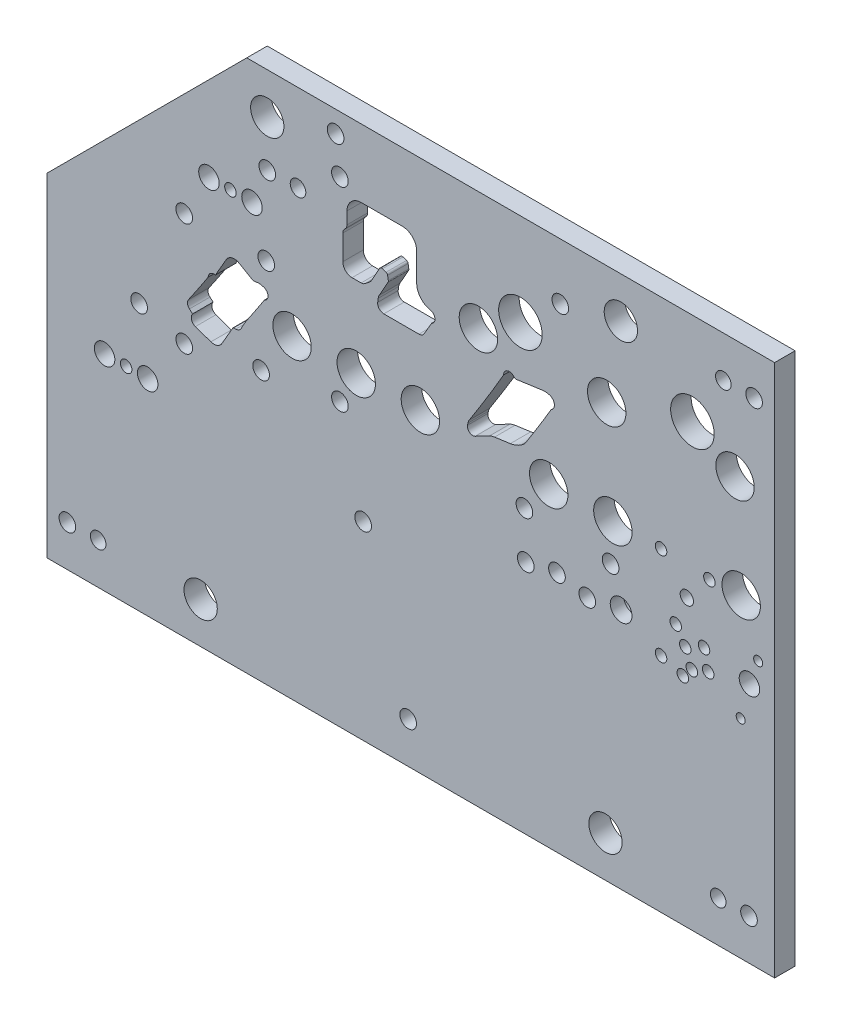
SolidWorks part; units mm, degrees
ref_plane "Front" through (0, 0, 0) normal (0, 0, 1) x (1, 0, 0)
ref_plane "Top" through (0, 0, 0) normal (0, 1, 0) x (1, 0, 0)
ref_plane "Right" through (0, 0, 0) normal (1, 0, 0) x (0, 0, -1)
sketch "Sketch1" plane through (0, 0, 0) normal (0, 0, 1) x (1, 0, 0)
  line L4 (-1196.34, -180.975) -> (-745.49, -180.975)
  line L5 (-1196.34, 25.4) -> (-1196.34, -180.975)
  line L6 (-745.49, 149.225) -> (-1072.515, 149.225)
  line L7 (-745.49, -180.975) -> (-745.49, 149.225)
  line L8 (-1196.34, -180.975) -> (-745.49, -180.975)
  line L9 (-1196.34, 25.4) -> (-1196.34, -180.975)
  line L10 (-745.49, 149.225) -> (-1072.515, 149.225)
  line L11 (-745.49, -180.975) -> (-745.49, 149.225)
  line L26 (-1072.515, 149.225) -> (-1196.34, 25.4)
  line L27 (-1072.515, 149.225) -> (-1196.34, 25.4)
  dimension "D1" = 0
extrude "Boss-Extrude1" add sketch "Sketch1" along normal blind 12.7 separate body
hole_wizard "Hole1" positions "Point_Sketch" profile "Profil_Sketch" hole size "Ø0.15" standard "ISO"
sketch "Point_Sketch" plane through (-798.7005, -36.6401, 0) normal (0, 0, 1) x (-1, 0, 0)
  point P0 (3.6543, 10.6011)
  point P2 (-1.9225, 4.5369)
sketch "Profil_Sketch" plane through (-802.3548, -47.2413, 0) normal (1, 0, 0) x (0, 1, 0)
  line L0 (0, 0) -> (0, 12.7)
  line L1 (0, 12.7) -> (3.5719, 12.7)
  line L2 (3.5719, 12.7) -> (3.5719, 0)
  line L5 (3.5719, 0) -> (0, 0)
  line L11 (0, -6.35) -> (0, 107.95) construction
  dimension "Diameter" = 7.1437
  dimension "Thru Hole Depth" = 12.7
other "usin_DL090<1>"
hole_wizard "Hole11" positions "Point_Sketch1" profile "Profil_Sketch1" hole size "Ø0.15" standard "ISO"
sketch "Point_Sketch1" plane through (-785.5665, -14.9521, 0) normal (0, 0, 1) x (-1, 0, 0)
  point P0 (3.6543, 10.6011)
sketch "Profil_Sketch1" plane through (-789.2208, -25.5532, 0) normal (1, 0, 0) x (0, 1, 0)
  line L0 (0, 0) -> (0, 12.7)
  line L1 (0, 12.7) -> (3.5719, 12.7)
  line L2 (3.5719, 12.7) -> (3.5719, 0)
  line L5 (3.5719, 0) -> (0, 0)
  line L11 (0, -6.35) -> (0, 107.95) construction
  dimension "Diameter" = 7.1437
  dimension "Thru Hole Depth" = 12.7
other "usin_DL090<2>"
hole_wizard "Hole12" positions "Point_Sketch2" profile "Profil_Sketch2" hole size "Ø0.15" standard "ISO"
sketch "Point_Sketch2" plane through (-803.1061, -11.0849, 0) normal (0, 0, 1) x (-1, 0, 0)
  point P0 (3.6543, 10.6011)
sketch "Profil_Sketch2" plane through (-806.7604, -21.6861, 0) normal (1, 0, 0) x (0, 1, 0)
  line L0 (0, 0) -> (0, 12.7)
  line L1 (0, 12.7) -> (3.5719, 12.7)
  line L2 (3.5719, 12.7) -> (3.5719, 0)
  line L5 (3.5719, 0) -> (0, 0)
  line L11 (0, -6.35) -> (0, 107.95) construction
  dimension "Diameter" = 7.1437
  dimension "Thru Hole Depth" = 12.7
other "usin_DL090<3>"
hole_wizard "Hole13" positions "Point_Sketch3" profile "Profil_Sketch3" hole size "Ø0.15" standard "ISO"
sketch "Point_Sketch3" plane through (-803.5274, 6.4914, 12.7) normal (0, 0, -1) x (1, 0, 0)
  point P0 (3.6543, 10.6011)
sketch "Profil_Sketch3" plane through (-799.8731, -4.1097, 12.7) normal (1, 0, 0) x (0, -1, 0)
  line L0 (0, 0) -> (0, 12.7)
  line L1 (0, 12.7) -> (4.1338, 12.7)
  line L2 (4.1338, 12.7) -> (4.1338, 0)
  line L5 (4.1338, 0) -> (0, 0)
  line L11 (0, -6.35) -> (0, 107.95) construction
  dimension "Diameter" = 8.2677
  dimension "Thru Hole Depth" = 12.7
other "usin_DL090_DAYTON VERSATILE INCH VPO-50-2130-P0.1999-W0.1310 X2-0<4>"
hole_wizard "Hole14" positions "Point_Sketch4" profile "Profil_Sketch4" hole size "Ø0.15" standard "ISO"
sketch "Point_Sketch4" plane through (-804.4841, -20.3493, 12.7) normal (0, 0, -1) x (1, 0, 0)
  point P0 (3.6543, 10.6011)
sketch "Profil_Sketch4" plane through (-800.8298, -30.9504, 12.7) normal (1, 0, 0) x (0, -1, 0)
  line L0 (0, 0) -> (0, 12.7)
  line L1 (0, 12.7) -> (3.5719, 12.7)
  line L2 (3.5719, 12.7) -> (3.5719, 0)
  line L5 (3.5719, 0) -> (0, 0)
  line L11 (0, -6.35) -> (0, 107.95) construction
  dimension "Diameter" = 7.1437
  dimension "Thru Hole Depth" = 12.7
other "usin_DL090<5>"
hole_wizard "Hole15" positions "Point_Sketch5" profile "Profil_Sketch5" hole size "Ø0.15" standard "ISO"
sketch "Point_Sketch5" plane through (-876.6775, -20.3493, 0) normal (0, 0, 1) x (-1, 0, 0)
  point P0 (3.6543, 10.6011)
sketch "Profil_Sketch5" plane through (-880.3318, -30.9504, 0) normal (1, 0, 0) x (0, 1, 0)
  line L0 (0, 0) -> (0, 12.7)
  line L1 (0, 12.7) -> (5.1594, 12.7)
  line L2 (5.1594, 12.7) -> (5.1594, 0)
  line L5 (5.1594, 0) -> (0, 0)
  line L11 (0, -6.35) -> (0, 107.95) construction
  dimension "Diameter" = 10.3187
  dimension "Thru Hole Depth" = 12.7
other "usin_DL090<6>"
hole_wizard "Hole17" positions "Point_Sketch7" profile "Profil_Sketch7" legacy
sketch "Point_Sketch7" plane through (-836.9265, -20.3493, 0) normal (0, 0, 1) x (-1, 0, 0)
  point P0 (3.6543, 10.6011)
sketch "Profil_Sketch7" plane through (-840.5808, -30.9504, 0) normal (1, 0, 0) x (0, 1, 0)
  line L0 (0, 0) -> (0, 12.7) construction
  line L1 (0, 12.7) -> (6.7469, 12.7)
  line L2 (6.7469, 12.7) -> (6.7469, 4.445)
  line L3 (6.7469, 4.445) -> (10.3187, 4.445)
  line L4 (10.3188, 0) -> (0, 0) construction
  line L5 (0, 12.7) -> (0, -1)
  line L6 (-6.7469, 4.445) -> (-10.3187, 4.445) construction
  line L7 (0, -4.2442) -> (0, 117.3081) construction
  line L8 (0, -1) -> (10.3188, -1)
  line L9 (10.3188, -1) -> (10.3187, 4.445)
  dimension "Diameter" = 13.4937
  dimension "Depth" = 12.7
  dimension "L1" = 4.445
  dimension "A1" = 180
  dimension "FixDim" = 1
other "usin_DS100<1>"
ref_plane "Plane1 QU250515L_Punch1[Mounted in the strip]-2"
sketch "Sketch1 QU250515L_Punch1[Mounted in the strip]-2" plane through (0, 0, 12.7) normal (0, 0, 1) x (1, 0, 0)
  line L7 (-935.5189, 21.735) -> (-935.7511, 20.4767)
  line L8 (-906.2222, 60.3125) -> (-907.5906, 61.4478)
  line L9 (-888.7721, 62.5554) -> (-905.7284, 60.1723)
  line L10 (-885.2997, 62.2271) -> (-886.9844, 62.5242)
  line L11 (-902.6471, 26.4559) -> (-901.3964, 27.3267)
  line L12 (-918.988, 22.5002) -> (-909.2346, 23.8709)
  line L13 (-930.9882, 16.9438) -> (-922.2381, 21.4652)
  line L14 (-935.5189, 21.735) -> (-935.7511, 20.4767)
  line L15 (-906.2222, 60.3125) -> (-907.5906, 61.4478)
  line L16 (-888.7721, 62.5554) -> (-905.7284, 60.1723)
  line L17 (-885.2997, 62.2271) -> (-886.9844, 62.5242)
  line L18 (-902.6471, 26.4559) -> (-901.3964, 27.3267)
  line L19 (-918.988, 22.5002) -> (-909.2346, 23.8709)
  line L20 (-930.9882, 16.9438) -> (-922.2381, 21.4652)
  arc A13 (-934.7197, 23.7493) -> (-935.5189, 21.735) centre (-930.0237, 20.7206) ccw
  arc A14 (-934.7197, 23.7493) -> (-913.3896, 58.6232) centre (-1653.9165, 487.596) ccw
  arc A15 (-907.5906, 61.4478) -> (-913.3896, 58.6232) centre (-909.851, 58.7234) ccw
  arc A16 (-906.2222, 60.3125) -> (-905.7284, 60.1723) centre (-905.8168, 60.8012) ccw
  arc A17 (-886.9844, 62.5242) -> (-888.7721, 62.5554) centre (-887.9768, 56.896) ccw
  arc A18 (-883.9457, 54.7215) -> (-885.2997, 62.2271) centre (-886.0054, 58.2249) ccw
  arc A19 (-899.8876, 28.893) -> (-883.9457, 54.7215) centre (-1614.1655, 487.596) ccw
  arc A20 (-901.3964, 27.3267) -> (-899.8876, 28.893) centre (-904.5895, 31.9125) ccw
  arc A21 (-909.2346, 23.8709) -> (-902.6471, 26.4559) centre (-911.3556, 38.9626) ccw
  arc A22 (-918.988, 22.5002) -> (-922.2381, 21.4652) centre (-917.574, 12.4391) ccw
  arc A23 (-935.7511, 20.4767) -> (-930.9882, 16.9438) centre (-932.504, 19.8773) ccw
  arc A24 (-934.7197, 23.7493) -> (-935.5189, 21.735) centre (-930.0237, 20.7206) ccw
  arc A25 (-934.7197, 23.7493) -> (-913.3896, 58.6232) centre (-1653.9165, 487.596) ccw
  arc A26 (-907.5906, 61.4478) -> (-913.3896, 58.6232) centre (-909.851, 58.7234) ccw
  arc A27 (-906.2222, 60.3125) -> (-905.7284, 60.1723) centre (-905.8168, 60.8012) ccw
  arc A28 (-886.9844, 62.5242) -> (-888.7721, 62.5554) centre (-887.9768, 56.896) ccw
  arc A29 (-883.9457, 54.7215) -> (-885.2997, 62.2271) centre (-886.0054, 58.2249) ccw
  arc A30 (-899.8876, 28.893) -> (-883.9457, 54.7215) centre (-1614.1655, 487.596) ccw
  arc A31 (-901.3964, 27.3267) -> (-899.8876, 28.893) centre (-904.5895, 31.9125) ccw
  arc A32 (-909.2346, 23.8709) -> (-902.6471, 26.4559) centre (-911.3556, 38.9626) ccw
  arc A33 (-918.988, 22.5002) -> (-922.2381, 21.4652) centre (-917.574, 12.4391) ccw
  arc A34 (-935.7511, 20.4767) -> (-930.9882, 16.9438) centre (-932.504, 19.8773) ccw
ref_plane "Plane1 QU250515L_Punch4[Mounted in the strip]-1"
sketch "Sketch1 QU250515L_Punch4[Mounted in the strip]-1" plane through (0, 0, 12.7) normal (0, 0, 1) x (1, 0, 0)
  line L10 (-987.6114, 54.3135) -> (-965.8621, 54.3135)
  line L11 (-991.0943, 60.8918) -> (-991.3898, 58.6134)
  line L12 (-985.2465, 76.1838) -> (-984.8109, 73.5354)
  line L13 (-988.4834, 78.0815) -> (-986.2272, 77.3325)
  line L14 (-999.3188, 64.6872) -> (-996.6929, 66.7362)
  line L15 (-1004.697, 63.881) -> (-1001.6626, 63.881)
  line L16 (-1010.412, 98.171) -> (-1010.412, 69.596)
  line L17 (-976.122, 107.061) -> (-1001.522, 107.061)
  line L18 (-967.232, 80.8774) -> (-967.232, 98.171)
  line L19 (-958.4084, 70.6586) -> (-960.0594, 71.1665)
  line L20 (-987.6114, 54.3135) -> (-965.8621, 54.3135)
  line L21 (-991.0943, 60.8918) -> (-991.3898, 58.6134)
  line L22 (-985.2465, 76.1838) -> (-984.8109, 73.5354)
  line L23 (-988.4834, 78.0815) -> (-986.2272, 77.3325)
  line L24 (-999.3188, 64.6872) -> (-996.6929, 66.7362)
  line L25 (-1004.697, 63.881) -> (-1001.6626, 63.881)
  line L26 (-1010.412, 98.171) -> (-1010.412, 69.596)
  line L27 (-976.122, 107.061) -> (-1001.522, 107.061)
  line L28 (-967.232, 80.8774) -> (-967.232, 98.171)
  line L29 (-958.4084, 70.6586) -> (-960.0594, 71.1665)
  arc A17 (-991.3898, 58.6134) -> (-987.6114, 54.3135) centre (-987.6114, 58.1235) ccw
  arc A18 (-990.4043, 62.946) -> (-991.0943, 60.8918) centre (-985.5527, 60.1732) ccw
  arc A19 (-990.4043, 62.946) -> (-984.9747, 72.5904) centre (-1733.4185, 487.596) ccw
  arc A20 (-984.9747, 72.5904) -> (-984.8109, 73.5354) centre (-986.2515, 73.2984) ccw
  arc A21 (-985.2465, 76.1838) -> (-986.2272, 77.3325) centre (-986.6871, 75.9469) ccw
  arc A22 (-988.4834, 78.0815) -> (-990.2216, 77.4013) centre (-988.9433, 76.6958) ccw
  arc A23 (-995.2714, 68.3821) -> (-990.2216, 77.4013) centre (-1733.4185, 487.596) ccw
  arc A24 (-996.6929, 66.7362) -> (-995.2714, 68.3821) centre (-1000.1305, 71.1417) ccw
  arc A25 (-1001.6626, 63.881) -> (-999.3188, 64.6872) centre (-1001.6626, 67.691) ccw
  arc A26 (-1010.412, 69.596) -> (-1004.697, 63.881) centre (-1004.697, 69.596) ccw
  arc A27 (-1001.522, 107.061) -> (-1010.412, 98.171) centre (-1001.522, 98.171) ccw
  arc A28 (-967.232, 98.171) -> (-976.122, 107.061) centre (-976.122, 98.171) ccw
  arc A29 (-967.232, 80.8774) -> (-960.0594, 71.1665) centre (-957.072, 80.8774) ccw
  arc A30 (-958.0004, 64.0452) -> (-958.4084, 70.6586) centre (-959.4493, 67.2751) ccw
  arc A31 (-962.5808, 56.1872) -> (-958.0004, 64.0452) centre (-1693.6675, 487.596) ccw
  arc A32 (-965.8621, 54.3135) -> (-962.5808, 56.1872) centre (-965.8621, 58.1235) ccw
  arc A33 (-991.3898, 58.6134) -> (-987.6114, 54.3135) centre (-987.6114, 58.1235) ccw
  arc A34 (-990.4043, 62.946) -> (-991.0943, 60.8918) centre (-985.5527, 60.1732) ccw
  arc A35 (-990.4043, 62.946) -> (-984.9747, 72.5904) centre (-1733.4185, 487.596) ccw
  arc A36 (-984.9747, 72.5904) -> (-984.8109, 73.5354) centre (-986.2515, 73.2984) ccw
  arc A37 (-985.2465, 76.1838) -> (-986.2272, 77.3325) centre (-986.6871, 75.9469) ccw
  arc A38 (-988.4834, 78.0815) -> (-990.2216, 77.4013) centre (-988.9433, 76.6958) ccw
  arc A39 (-995.2714, 68.3821) -> (-990.2216, 77.4013) centre (-1733.4185, 487.596) ccw
  arc A40 (-996.6929, 66.7362) -> (-995.2714, 68.3821) centre (-1000.1305, 71.1417) ccw
  arc A41 (-1001.6626, 63.881) -> (-999.3188, 64.6872) centre (-1001.6626, 67.691) ccw
  arc A42 (-1010.412, 69.596) -> (-1004.697, 63.881) centre (-1004.697, 69.596) ccw
  arc A43 (-1001.522, 107.061) -> (-1010.412, 98.171) centre (-1001.522, 98.171) ccw
  arc A44 (-967.232, 98.171) -> (-976.122, 107.061) centre (-976.122, 98.171) ccw
  arc A45 (-967.232, 80.8774) -> (-960.0594, 71.1665) centre (-957.072, 80.8774) ccw
  arc A46 (-958.0004, 64.0452) -> (-958.4084, 70.6586) centre (-959.4493, 67.2751) ccw
  arc A47 (-962.5808, 56.1872) -> (-958.0004, 64.0452) centre (-1693.6675, 487.596) ccw
  arc A48 (-965.8621, 54.3135) -> (-962.5808, 56.1872) centre (-965.8621, 58.1235) ccw
ref_plane "Plane1 QU250515L_Punch5[Mounted in the strip]-2"
sketch "Sketch1 QU250515L_Punch5[Mounted in the strip]-2" plane through (0, 0, 12.7) normal (0, 0, 1) x (1, 0, 0)
  line L9 (-1080.5961, 0.2711) -> (-1079.3261, 0.2711)
  line L10 (-1061.6993, 31.325) -> (-1062.1784, 31.4939)
  line L11 (-1069.5951, 32.2499) -> (-1077.3993, 36.7556)
  line L12 (-1085.2061, 34.6638) -> (-1091.9762, 22.9377)
  line L14 (-1108.0194, -3.2428) -> (-1106.0659, -4.9392)
  line L15 (-1104.3303, -10.8785) -> (-1094.7387, -14.2592)
  line L16 (-1087.8896, -11.7267) -> (-1081.146, -0.0464)
  line L17 (-1080.5961, 0.2711) -> (-1079.3261, 0.2711)
  line L18 (-1061.6993, 31.325) -> (-1062.1784, 31.4939)
  line L19 (-1069.5951, 32.2499) -> (-1077.3993, 36.7556)
  line L20 (-1085.2061, 34.6638) -> (-1091.9762, 22.9377)
  line L22 (-1108.0194, -3.2428) -> (-1106.0659, -4.9392)
  line L23 (-1104.3303, -10.8785) -> (-1094.7387, -14.2592)
  line L24 (-1087.8896, -11.7267) -> (-1081.146, -0.0464)
  arc A17 (-1079.3261, 0.2711) -> (-1075.8992, 2.4159) centre (-1079.3261, 4.0811) ccw
  arc A18 (-1072.3486, 8.5851) -> (-1075.8992, 2.4159) centre (-1030.0901, -19.8428) ccw
  arc A19 (-1072.3486, 8.5851) -> (-1061.6159, 24.6782) centre (-1773.1695, 487.596) ccw
  arc A20 (-1061.6159, 24.6782) -> (-1061.6993, 31.325) centre (-1062.876, 27.9863) ccw
  arc A21 (-1062.1784, 31.4939) -> (-1066.9232, 31.8175) centre (-1065.1336, 23.1095) ccw
  arc A22 (-1069.5951, 32.2499) -> (-1066.9232, 31.8175) centre (-1067.6901, 35.5495) ccw
  arc A23 (-1077.3993, 36.7556) -> (-1085.2061, 34.6638) centre (-1080.2568, 31.8063) ccw
  arc A25 (-1091.9762, 22.9377) -> (-1096.4074, 19.6145) centre (-1092.8689, 19.5121) ccw
  arc A26 (-1108.6116, 1.441) -> (-1096.4074, 19.6145) centre (-1812.9205, 487.596) ccw
  arc A27 (-1108.6116, 1.441) -> (-1108.0194, -3.2428) centre (-1105.6982, -0.57) ccw
  arc A28 (-1106.0659, -4.9392) -> (-1104.3303, -10.8785) centre (-1103.0637, -7.2851) ccw
  arc A29 (-1094.7387, -14.2592) -> (-1087.8896, -11.7267) centre (-1092.8389, -8.8692) ccw
  arc A30 (-1080.5961, 0.2711) -> (-1081.146, -0.0464) centre (-1080.5961, -0.3639) ccw
  arc A31 (-1079.3261, 0.2711) -> (-1075.8992, 2.4159) centre (-1079.3261, 4.0811) ccw
  arc A32 (-1072.3486, 8.5851) -> (-1075.8992, 2.4159) centre (-1030.0901, -19.8428) ccw
  arc A33 (-1072.3486, 8.5851) -> (-1061.6159, 24.6782) centre (-1773.1695, 487.596) ccw
  arc A34 (-1061.6159, 24.6782) -> (-1061.6993, 31.325) centre (-1062.876, 27.9863) ccw
  arc A35 (-1062.1784, 31.4939) -> (-1066.9232, 31.8175) centre (-1065.1336, 23.1095) ccw
  arc A36 (-1069.5951, 32.2499) -> (-1066.9232, 31.8175) centre (-1067.6901, 35.5495) ccw
  arc A37 (-1077.3993, 36.7556) -> (-1085.2061, 34.6638) centre (-1080.2568, 31.8063) ccw
  arc A39 (-1091.9762, 22.9377) -> (-1096.4074, 19.6145) centre (-1092.8689, 19.5121) ccw
  arc A40 (-1108.6116, 1.441) -> (-1096.4074, 19.6145) centre (-1812.9205, 487.596) ccw
  arc A41 (-1108.6116, 1.441) -> (-1108.0194, -3.2428) centre (-1105.6982, -0.57) ccw
  arc A42 (-1106.0659, -4.9392) -> (-1104.3303, -10.8785) centre (-1103.0637, -7.2851) ccw
  arc A43 (-1094.7387, -14.2592) -> (-1087.8896, -11.7267) centre (-1092.8389, -8.8692) ccw
  arc A44 (-1080.5961, 0.2711) -> (-1081.146, -0.0464) centre (-1080.5961, -0.3639) ccw
hole_wizard "Hole18" positions "Point_Sketch8" profile "Profil_Sketch8" hole size "Ø0.15" standard "ISO"
sketch "Point_Sketch8" plane through (-766.3467, 86.4963, 0) normal (0, 0, 1) x (-1, 0, 0)
  point P0 (3.6543, 10.6011)
  point P2 (83.1563, 10.6011)
  point P4 (162.6583, 10.6011)
  point P6 (278.1013, 72.5263)
  point P8 (238.3503, 72.5263)
  point P10 (198.5993, 72.5263)
  point P12 (119.0973, 72.5263)
  point P14 (-0.1557, 72.5263)
  point P16 (79.3463, 72.5263)
sketch "Profil_Sketch8" plane through (-770.001, 75.8952, 0) normal (1, 0, 0) x (0, 1, 0)
  line L0 (0, 0) -> (0, 12.7)
  line L1 (0, 12.7) -> (11.9062, 12.7)
  line L2 (11.9062, 12.7) -> (11.9062, 0)
  line L5 (11.9062, 0) -> (0, 0)
  line L11 (0, -6.35) -> (0, 107.95) construction
  dimension "Diameter" = 23.8125
  dimension "Thru Hole Depth" = 12.7
other "usin_DL090<7>"
hole_wizard "Hole19" positions "Point_Sketch9" profile "Profil_Sketch9" hole size "Ø0.15" standard "ISO"
sketch "Point_Sketch9" plane through (-796.8963, 102.6761, 12.7) normal (0, 0, -1) x (1, 0, 0)
  point P0 (0.4793, 10.6011)
  point P2 (-106.0737, 10.6011)
sketch "Profil_Sketch9" plane through (-796.417, 92.075, 12.7) normal (1, 0, 0) x (0, -1, 0)
  line L0 (0, 0) -> (0, 12.7)
  line L1 (0, 12.7) -> (13.4937, 12.7)
  line L2 (13.4937, 12.7) -> (13.4937, 0)
  line L5 (13.4937, 0) -> (0, 0)
  line L11 (0, -6.35) -> (0, 107.95) construction
  dimension "Diameter" = 26.9875
  dimension "Thru Hole Depth" = 12.7
other "usin_DL090<8>"
hole_wizard "Hole110" positions "Point_Sketch10" profile "Profil_Sketch10" hole size "Ø0.15" standard "ISO"
sketch "Point_Sketch10" plane through (-761.8443, 134.4261, 12.7) normal (0, 0, -1) x (1, 0, 0)
  point P0 (3.6543, 10.6011)
  point P2 (0.4793, 290.0011)
  point P4 (-421.7957, 290.0011)
  point P6 (-297.9707, 39.1761)
  point P8 (-238.5347, 197.9261)
  point P10 (-85.2457, 143.9511)
  point P12 (-210.6582, 290.0011)
  point P14 (-377.3457, 150.3011)
sketch "Profil_Sketch10" plane through (-758.19, 123.825, 12.7) normal (1, 0, 0) x (0, -1, 0)
  line L0 (0, 0) -> (0, 12.7)
  line L1 (0, 12.7) -> (5.1562, 12.7)
  line L2 (5.1562, 12.7) -> (5.1562, 0)
  line L5 (5.1562, 0) -> (0, 0)
  line L11 (0, -6.35) -> (0, 107.95) construction
  dimension "Diameter" = 10.3124
  dimension "Thru Hole Depth" = 12.7
other "usin_DL090_.375-16x1.75-SHCS<9>"
hole_wizard "Hole111" positions "Point_Sketch11" profile "Profil_Sketch11" hole size "Ø0.15" standard "ISO"
sketch "Point_Sketch11" plane through (-1160.9357, -144.9739, 0) normal (0, 0, 1) x (-1, 0, 0)
  point P0 (3.6543, 10.6011)
  point P2 (-120.1707, -240.2239)
  point P4 (-383.6957, -268.7989)
  point P6 (-380.5207, 10.6011)
sketch "Profil_Sketch11" plane through (-1164.59, -155.575, 0) normal (1, 0, 0) x (0, 1, 0)
  line L0 (0, 0) -> (0, 12.7)
  line L1 (0, 12.7) -> (4.826, 12.7)
  line L2 (4.826, 12.7) -> (4.826, 0)
  line L5 (4.826, 0) -> (0, 0)
  line L11 (0, -6.35) -> (0, 107.95) construction
  dimension "Diameter" = 9.652
  dimension "Thru Hole Depth" = 12.7
other "usin_DL090_.375 x 2.00 DOWEL PIN<10>"
hole_wizard "Hole112" positions "Point_Sketch12" profile "Profil_Sketch12" hole size "Ø0.15" standard "ISO"
sketch "Point_Sketch12" plane through (-1104.7443, -144.9739, 12.7) normal (0, 0, -1) x (1, 0, 0)
  point P0 (3.6543, 10.6011)
  point P2 (44.9293, -268.7989)
  point P4 (264.0043, -268.7989)
  point P6 (254.4793, 10.6011)
sketch "Profil_Sketch12" plane through (-1101.09, -155.575, 12.7) normal (1, 0, 0) x (0, -1, 0)
  line L0 (0, 0) -> (0, 12.7)
  line L1 (0, 12.7) -> (10.3187, 12.7)
  line L2 (10.3187, 12.7) -> (10.3187, 0)
  line L5 (10.3187, 0) -> (0, 0)
  line L11 (0, -6.35) -> (0, 107.95) construction
  dimension "Diameter" = 20.6375
  dimension "Thru Hole Depth" = 12.7
other "usin_DL090<11>"
hole_wizard "Hole113" positions "Point_Sketch13" profile "Profil_Sketch13" hole size "Ø0.15" standard "ISO"
sketch "Point_Sketch13" plane through (-904.1478, 10.6011, 12.7) normal (0, 0, -1) x (1, 0, 0)
  point P0 (3.6543, 16.9511)
  point P2 (25.8793, -103.6989)
  point P4 (-110.6457, -103.6989)
  point P6 (-110.6457, 16.9511)
sketch "Profil_Sketch13" plane through (-900.4935, -6.35, 12.7) normal (1, 0, 0) x (0, -1, 0)
  line L0 (0, 0) -> (0, 12.7)
  line L1 (0, 12.7) -> (5.1562, 12.7)
  line L2 (5.1562, 12.7) -> (5.1562, 0)
  line L5 (5.1562, 0) -> (0, 0)
  line L11 (0, -6.35) -> (0, 107.95) construction
  dimension "Diameter" = 10.3124
  dimension "Thru Hole Depth" = 12.7
other "usin_DL090_.375-16x1.75-SHCS<12>"
hole_wizard "Hole114" positions "Point_Sketch14" profile "Profil_Sketch14" hole size "Ø0.15" standard "ISO"
sketch "Point_Sketch14" plane through (-1114.9043, -12.8939, 12.7) normal (0, 0, -1) x (1, 0, 0)
  point P0 (3.6543, 10.6011)
  point P2 (51.2793, 1.0761)
  point P4 (54.4543, -59.2489)
  point P6 (3.6543, -59.2489)
sketch "Profil_Sketch14" plane through (-1111.25, -23.495, 12.7) normal (1, 0, 0) x (0, -1, 0)
  line L0 (0, 0) -> (0, 12.7)
  line L1 (0, 12.7) -> (5.1562, 12.7)
  line L2 (5.1562, 12.7) -> (5.1562, 0)
  line L5 (5.1562, 0) -> (0, 0)
  line L11 (0, -6.35) -> (0, 107.95) construction
  dimension "Diameter" = 10.3124
  dimension "Thru Hole Depth" = 12.7
other "usin_DL090_.375-16x1.75-SHCS<13>"
hole_wizard "Hole115" positions "Point_Sketch15" profile "Profil_Sketch15" hole size "Ø0.15" standard "ISO"
sketch "Point_Sketch15" plane through (-819.5023, 24.7795, 12.7) normal (0, 0, -1) x (1, 0, 0)
  point P0 (3.6543, 10.6011)
  point P2 (33.6263, 12.2355)
  point P4 (32.8643, 61.9989)
  point P6 (3.6543, 67.9546)
sketch "Profil_Sketch15" plane through (-815.848, 14.1783, 12.7) normal (1, 0, 0) x (0, -1, 0)
  line L0 (0, 0) -> (0, 12.7)
  line L1 (0, 12.7) -> (3.5687, 12.7)
  line L2 (3.5687, 12.7) -> (3.5687, 0)
  line L5 (3.5687, 0) -> (0, 0)
  line L11 (0, -6.35) -> (0, 107.95) construction
  dimension "Diameter" = 7.1374
  dimension "Thru Hole Depth" = 12.7
other "usin_DL090_.25-20x1.5-SHCS<14>"
hole_wizard "Hole116" positions "Point_Sketch16" profile "Profil_Sketch16" hole size "Ø0.15" standard "ISO"
sketch "Point_Sketch16" plane through (-1078.9572, 83.9436, 0) normal (0, 0, 1) x (-1, 0, 0)
  point P0 (3.6543, 10.6011)
sketch "Profil_Sketch16" plane through (-1082.6115, 73.3425, 0) normal (1, 0, 0) x (0, 1, 0)
  line L0 (0, 0) -> (0, 12.7)
  line L1 (0, 12.7) -> (3.5687, 12.7)
  line L2 (3.5687, 12.7) -> (3.5687, 0)
  line L5 (3.5687, 0) -> (0, 0)
  line L11 (0, -6.35) -> (0, 107.95) construction
  dimension "Diameter" = 7.1374
  dimension "Thru Hole Depth" = 12.7
other "usin_DL090_.25x1.25-SHSB-(#10-24)<15>"
hole_wizard "Hole117" positions "Point_Sketch17" profile "Profil_Sketch17" hole size "Ø0.15" standard "ISO"
sketch "Point_Sketch17" plane through (-1092.2922, 83.9436, 0) normal (0, 0, 1) x (-1, 0, 0)
  point P0 (3.6543, 10.6011)
  point P2 (-23.0157, 10.6011)
sketch "Profil_Sketch17" plane through (-1095.9465, 73.3425, 0) normal (1, 0, 0) x (0, 1, 0)
  line L0 (0, 0) -> (0, 12.7)
  line L1 (0, 12.7) -> (6.35, 12.7)
  line L2 (6.35, 12.7) -> (6.35, 0)
  line L5 (6.35, 0) -> (0, 0)
  line L11 (0, -6.35) -> (0, 107.95) construction
  dimension "Diameter" = 12.7
  dimension "Thru Hole Depth" = 12.7
other "usin_DL090_RAYMOND DIE SPRINGS INCH 103-208<16>"
hole_wizard "Copy of P250520L_.25x1.25-SHSB-(#10-24)-2 Hole116" positions "Sketch19" profile "Sketch21" hole size "Ø0.15" standard "ISO"
sketch "Sketch19" plane through (-967.2607, -5.2739, 0) normal (0, 0, 1) x (-1, 0, 0)
  point P0 (179.9938, 48.3836)
sketch "Sketch21" plane through (-1147.2545, -53.6575, 0) normal (1, 0, 0) x (0, 1, 0)
  line L0 (0, 0) -> (0, 12.7)
  line L1 (0, 12.7) -> (3.5687, 12.7)
  line L2 (3.5687, 12.7) -> (3.5687, 0)
  line L5 (3.5687, 0) -> (0, 0)
  line L11 (0, -6.35) -> (0, 107.95) construction
  dimension "Diameter" = 7.1374
  dimension "Thru Hole Depth" = 12.7
other "Copy of P250520L_.25x1.25-SHSB-(#10-24)-2 usin_DL090_.25x1.25-SHSB-(#10-24)<15>"
hole_wizard "Copy of P250520L_.25x1.25-SHSB-(#10-24)-2 Hole117" positions "Sketch23" profile "Sketch25" hole size "Ø0.15" standard "ISO"
sketch "Sketch23" plane through (-980.5957, -5.2739, 0) normal (0, 0, 1) x (-1, 0, 0)
  point P0 (179.9938, 48.3836)
  point P2 (153.3238, 48.3836)
sketch "Sketch25" plane through (-1160.5895, -53.6575, 0) normal (1, 0, 0) x (0, 1, 0)
  line L0 (0, 0) -> (0, 12.7)
  line L1 (0, 12.7) -> (6.35, 12.7)
  line L2 (6.35, 12.7) -> (6.35, 0)
  line L5 (6.35, 0) -> (0, 0)
  line L11 (0, -6.35) -> (0, 107.95) construction
  dimension "Diameter" = 12.7
  dimension "Thru Hole Depth" = 12.7
other "Copy of P250520L_.25x1.25-SHSB-(#10-24)-2 usin_DL090_RAYMOND DIE SPRINGS INCH 103-208<16>"
hole_wizard "Hole118" positions "Point_Sketch18" profile "Profil_Sketch18" hole size "Ø0.15" standard "ISO"
sketch "Point_Sketch18" plane through (-903.3223, -24.3239, 12.7) normal (0, 0, -1) x (1, 0, 0)
  point P0 (3.6543, 10.6011)
  point P2 (41.7543, 10.6011)
sketch "Profil_Sketch18" plane through (-899.668, -34.925, 12.7) normal (1, 0, 0) x (0, -1, 0)
  line L0 (0, 0) -> (0, 12.7)
  line L1 (0, 12.7) -> (5.1562, 12.7)
  line L2 (5.1562, 12.7) -> (5.1562, 0)
  line L5 (5.1562, 0) -> (0, 0)
  line L11 (0, -6.35) -> (0, 107.95) construction
  dimension "Diameter" = 10.3124
  dimension "Thru Hole Depth" = 12.7
other "usin_DL090_.375-16x1.75-SHCS<17>"
hole_wizard "Hole119" positions "Point_Sketch19" profile "Profil_Sketch19" hole size "Ø0.15" standard "ISO"
sketch "Point_Sketch19" plane through (-1021.1148, 146.2209, 12.7) normal (0, 0, -1) x (1, 0, 0)
  point P0 (3.6543, 10.2039)
sketch "Profil_Sketch19" plane through (-1017.4605, 136.017, 12.7) normal (1, 0, 0) x (0, -1, 0)
  line L0 (0, 0) -> (0, 12.7)
  line L1 (0, 12.7) -> (5.1594, 12.7)
  line L2 (5.1594, 12.7) -> (5.1594, 0)
  line L5 (5.1594, 0) -> (0, 0)
  line L11 (0, -6.35) -> (0, 107.95) construction
  dimension "Diameter" = 10.3187
  dimension "Thru Hole Depth" = 12.7
other "usin_DL090<18>"
extrude "Cut-Extrude1 QU250515L_Punch1[Mounted in the strip]-2" cut sketch "Sketch1 QU250515L_Punch1[Mounted in the strip]-2" against normal through all
extrude "Cut-Extrude1 QU250515L_Punch5[Mounted in the strip]-2" cut sketch "Sketch1 QU250515L_Punch5[Mounted in the strip]-2" against normal through all
extrude "Cut-Extrude1 QU250515L_Punch4[Mounted in the strip]-1" cut sketch "Sketch1 QU250515L_Punch4[Mounted in the strip]-1" against normal through all
sketch "Sketch1 _Machining axis" plane through (0, 0, 12.7) normal (0, 0, 1) x (1, 0, 0)
  line L0 (-988.822, 101.981) -> (-988.822, 107.061) construction
  line L1 (-976.122, 107.061) -> (-1001.522, 107.061) construction
  line L2 (-1076.0372, 30.1034) -> (-1073.4972, 34.5028) construction
  line L3 (-1069.5951, 32.2499) -> (-1077.3993, 36.7556) construction
  line L4 (-896.5433, 56.3333) -> (-897.2503, 61.3639) construction
  line L5 (-888.7721, 62.5554) -> (-905.7284, 60.1723) construction
  point P0 (-988.822, 101.981)
  point P5 (-1076.0372, 30.1034)
  point P10 (-896.5433, 56.3333)
sketch "Sketch1 _Wire EDM" plane through (0, 0, 12.7) normal (0, 0, 1) x (1, 0, 0)
  circle A0 centre (-988.822, 101.981) radius 3.175
  circle A1 centre (-1076.0372, 30.1034) radius 3.175
  circle A2 centre (-896.5433, 56.3333) radius 3.175
hole_wizard "Hole120" positions "Point_Sketch20" profile "Profil_Sketch20" hole size "Ø0.15" standard "ISO"
sketch "Point_Sketch20" plane through (-757.4245, -20.3493, 0) normal (0, 0, 1) x (-1, 0, 0)
  point P0 (3.6543, 10.6011)
sketch "Profil_Sketch20" plane through (-761.0788, -30.9504, 0) normal (1, 0, 0) x (0, 1, 0)
  line L0 (0, 0) -> (0, 12.7)
  line L1 (0, 12.7) -> (6.35, 12.7)
  line L2 (6.35, 12.7) -> (6.35, 0)
  line L5 (6.35, 0) -> (0, 0)
  line L11 (0, -6.35) -> (0, 107.95) construction
  dimension "Diameter" = 12.7
  dimension "Thru Hole Depth" = 12.7
other "usin_DL090<19>"
hole_wizard "Hole121" positions "Point_Sketch21" profile "Profil_Sketch21" hole size "Ø0.15" standard "ISO"
sketch "Point_Sketch21" plane through (-759.3356, -8.5677, 12.7) normal (0, 0, -1) x (1, 0, 0)
  point P0 (3.6543, 7.4261)
  point P2 (-7.1407, 43.6211)
sketch "Profil_Sketch21" plane through (-755.6813, -15.9939, 12.7) normal (1, 0, 0) x (0, -1, 0)
  line L0 (0, 0) -> (0, 12.7)
  line L1 (0, 12.7) -> (2.8067, 12.7)
  line L2 (2.8067, 12.7) -> (2.8067, 0)
  line L5 (2.8067, 0) -> (0, 0)
  line L11 (0, -6.35) -> (0, 107.95) construction
  dimension "Diameter" = 5.6134
  dimension "Thru Hole Depth" = 12.7
other "usin_DL090_.25-20x1.75-SHCS<20>"
sketch "Sketch28" plane through (0, 0, 12.7) normal (0, 0, 1) x (1, 0, 0)
  line L2 (-1010.412, 98.171) -> (-1010.412, 69.596) construction
  line L3 (-1010.412, 69.596) -> (-1010.412, 90.6942)
  line L4 (-1004.697, 63.881) -> (-1007.298, 63.881)
  line L5 (-1013.013, 69.596) -> (-1013.013, 84.963)
  line L6 (-1004.697, 63.881) -> (-1007.298, 63.881)
  line L7 (-1013.013, 69.596) -> (-1013.013, 84.963)
  arc A3 (-1010.412, 69.596) -> (-1004.697, 63.881) centre (-1004.697, 69.596) ccw construction
  arc A4 (-1010.412, 69.596) -> (-1004.697, 63.881) centre (-1004.697, 69.596) ccw
  arc A5 (-1010.412, 90.6942) -> (-1011.7125, 87.8286) centre (-1014.2195, 90.6942) cw
  arc A6 (-1013.013, 69.596) -> (-1007.298, 63.881) centre (-1007.298, 69.596) ccw
  arc A7 (-1009.8939, 88.7077) -> (-1013.013, 84.963) centre (-1009.2055, 84.963) ccw
  arc A8 (-1013.013, 69.596) -> (-1007.298, 63.881) centre (-1007.298, 69.596) ccw
  arc A9 (-1011.7125, 87.8286) -> (-1013.013, 84.963) centre (-1009.2055, 84.963) ccw
  dimension "D1" = 2.22
extrude "Cut-Extrude1" cut sketch "Sketch28" against normal through all
